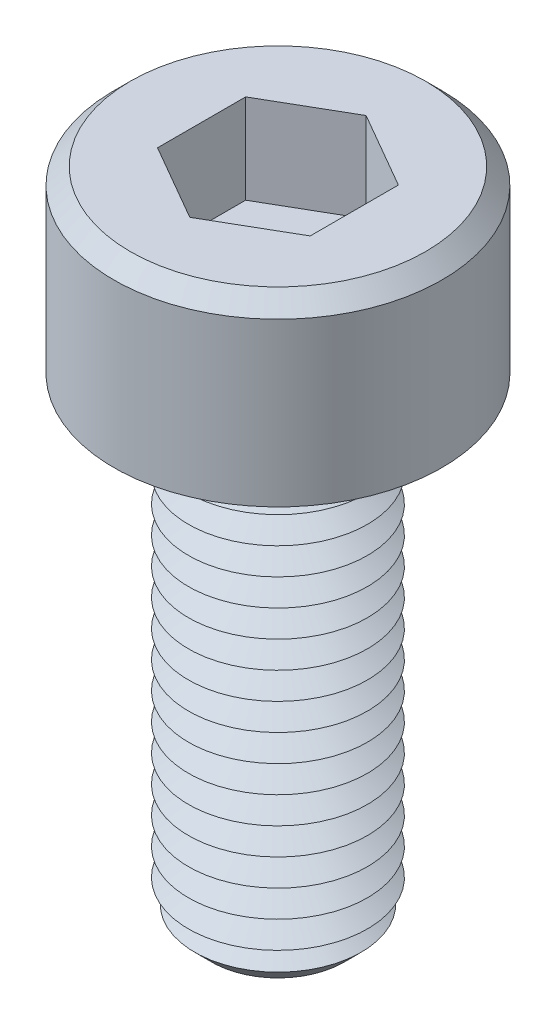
SolidWorks part; units mm, degrees
ref_plane "Front x-y" through (0, 0, 0) normal (0, 0, 1) x (1, 0, 0)
ref_plane "Top x-z" through (0, 0, 0) normal (0, 1, 0) x (1, 0, 0)
ref_plane "Side y-z" through (0, 0, 0) normal (1, 0, 0) x (0, 0, -1)
sketch "Sketch1" plane through (0, 0, 0) normal (0, 0, 1) x (1, 0, 0)
  line L0 (0, 0) -> (2.75, 0)
  line L1 (2.75, 0) -> (2.75, 2.725)
  line L2 (2.75, 2.725) -> (2.475, 3)
  line L3 (2.475, 3) -> (0, 3)
  line L4 (0, 3) -> (0, 0)
  line L5 (0, 0) -> (0, 100) construction
revolve "Base-Revolve" add sketch "Sketch1" angle 360 about L5
sketch "Sketch2" plane through (0, 0, 0) normal (0, 0, 1) x (1, 0, 0)
  line L0 (0, 0) -> (0, 100) construction
  line L1 (0, -8) -> (1.1087, -8)
  line L2 (1.1087, -8) -> (1.3956, -7.7131)
  line L3 (1.3956, -7.7131) -> (1.1087, -7.5482)
  line L4 (1.1087, -7.5482) -> (1.5, -7.3223)
  line L5 (1.5, -7.3223) -> (1.1087, -7.0963)
  line L6 (1.1087, -7.0963) -> (1.5, -6.8704)
  line L7 (1.5, -6.8704) -> (1.1087, -6.6445)
  line L8 (1.1087, -6.6445) -> (1.5, -6.4186)
  line L9 (1.5, -6.4186) -> (1.1087, -6.1927)
  line L10 (1.1087, -6.1927) -> (1.5, -5.9668)
  line L11 (1.5, -5.9668) -> (1.1087, -5.7408)
  line L12 (1.1087, -5.7408) -> (1.5, -5.5149)
  line L13 (1.5, -5.5149) -> (1.1087, -5.289)
  line L14 (1.1087, -5.289) -> (1.5, -5.0631)
  line L15 (1.5, -5.0631) -> (1.1087, -4.8372)
  line L16 (1.1087, -4.8372) -> (1.5, -4.6113)
  line L17 (1.5, -4.6113) -> (1.1087, -4.3853)
  line L18 (1.1087, -4.3853) -> (1.5, -4.1594)
  line L19 (1.5, -4.1594) -> (1.1087, -3.9335)
  line L20 (1.1087, -3.9335) -> (1.5, -3.7076)
  line L21 (1.5, -3.7076) -> (1.1087, -3.4817)
  line L22 (1.1087, -3.4817) -> (1.5, -3.2558)
  line L23 (1.5, -3.2558) -> (1.1087, -3.0299)
  line L24 (1.1087, -3.0299) -> (1.5, -2.8039)
  line L25 (1.5, -2.8039) -> (1.1087, -2.578)
  line L26 (1.1087, -2.578) -> (1.5, -2.3521)
  line L27 (1.5, -2.3521) -> (1.1087, -2.1262)
  line L28 (1.1087, -2.1262) -> (1.5, -1.9003)
  line L29 (1.5, -1.9003) -> (1.1087, -1.6744)
  line L30 (1.1087, -1.6744) -> (1.5, -1.4484)
  line L31 (1.5, -1.4484) -> (1.1087, -1.2225)
  line L32 (1.1087, -1.2225) -> (1.5, -0.9966)
  line L33 (1.5, -0.9966) -> (1.1087, -0.7707)
  line L34 (1.1087, -0.7707) -> (1.5, -0.5448)
  line L35 (1.5, -0.5448) -> (1.1087, -0.3189)
  line L36 (1.1087, -0.3189) -> (1.5, -0.0929)
  line L37 (1.5, -0.0929) -> (1.5, 0)
  line L38 (1.5, 0) -> (0, 0)
  line L39 (0, 0) -> (0, -8)
revolve "Boss-Revolve1" add sketch "Sketch2" angle 360 about L0
ref_plane "Plane1" through (0, 3, 0) normal (0, 1, 0) x (-1, 0, 0)
sketch "Sketch3" plane through (0, 3, 0) normal (0, 1, 0) x (-1, 0, 0)
  line L0 (1.28, 0.739) -> (0, 1.478)
  line L1 (0, 1.478) -> (-1.28, 0.739)
  line L2 (-1.28, 0.739) -> (-1.28, -0.739)
  line L3 (-1.28, -0.739) -> (0, -1.478)
  line L4 (0, -1.478) -> (1.28, -0.739)
  line L5 (1.28, -0.739) -> (1.28, 0.739)
extrude "Cut-Extrude1" cut sketch "Sketch3" against normal blind 1.5
